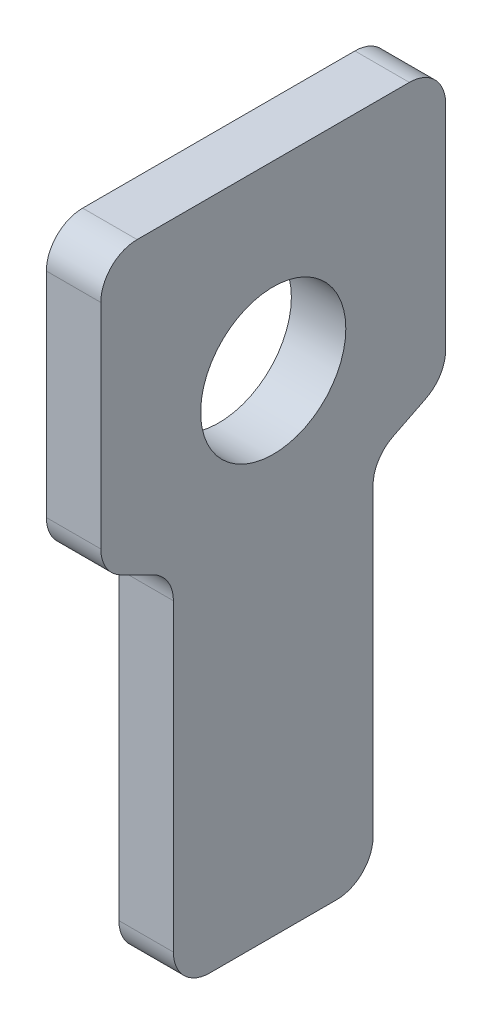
SolidWorks part; units mm, degrees
ref_plane "Front Plane" through (0, 0, 0) normal (0, 0, 1) x (1, 0, 0)
ref_plane "Top Plane" through (0, 0, 0) normal (0, 1, 0) x (1, 0, 0)
ref_plane "Right Plane" through (0, 0, 0) normal (1, 0, 0) x (0, 0, -1)
sketch "Sketch1" plane through (0, 0, 0) normal (1, 0, 0) x (0, 0, -1)
  line L0 (0, 24.7719) -> (0, -39.9686) construction
  line L1 (9.5, 10) -> (9.5, -5)
  line L2 (9.5, -5) -> (5.5, -7)
  line L3 (5.5, -7) -> (5.5, -27)
  line L4 (-5.5, -7) -> (-5.5, -27)
  line L5 (-9.5, -5) -> (-5.5, -7)
  line L6 (-9.5, 10) -> (-9.5, -5)
  line L7 (-9.5, 10) -> (9.5, 10)
  line L8 (-5.5, -27) -> (5.5, -27)
  circle A0 centre (0, 0) radius 4
  dimension "D1" = 8
  dimension "D3" = 10
  dimension "D2" = 11
  dimension "D4" = 37
  dimension "D5" = 15
  dimension "D6" = 19
  dimension "D7" = 20
extrude "Boss-Extrude1" add sketch "Sketch1" along normal blind 3
fillet "Fillet1" radius 2 8 edges at (1.5, -7, -5.5) (1.5, -7, 5.5) (1.5, -5, 9.5) (1.5, -5, -9.5) (1.5, -27, -5.5) (1.5, -27, 5.5) (1.5, 10, -9.5) (1.5, 10, 9.5)
